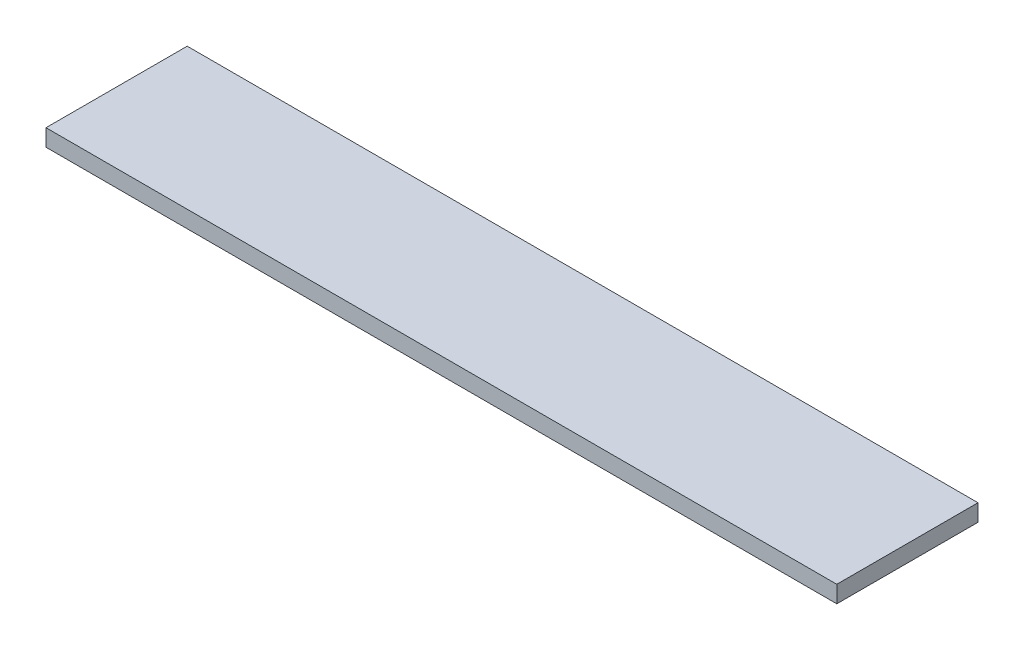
SolidWorks part; units mm, degrees
ref_plane "Front Plane" through (0, 0, 0) normal (0, 0, 1) x (1, 0, 0)
ref_plane "Top Plane" through (0, 0, 0) normal (0, 1, 0) x (1, 0, 0)
ref_plane "Right Plane" through (0, 0, 0) normal (1, 0, 0) x (0, 0, -1)
sketch "Sketch1" plane through (0, 0, 0) normal (0, 1, 0) x (1, 0, 0)
  line L1 (0, 0) -> (280, 0)
  line L2 (0, 0) -> (0, 50)
  line L3 (0, 50) -> (280, 50)
  line L4 (280, 0) -> (280, 50)
extrude "Boss-Extrude1" add sketch "Sketch1" along normal blind 6
